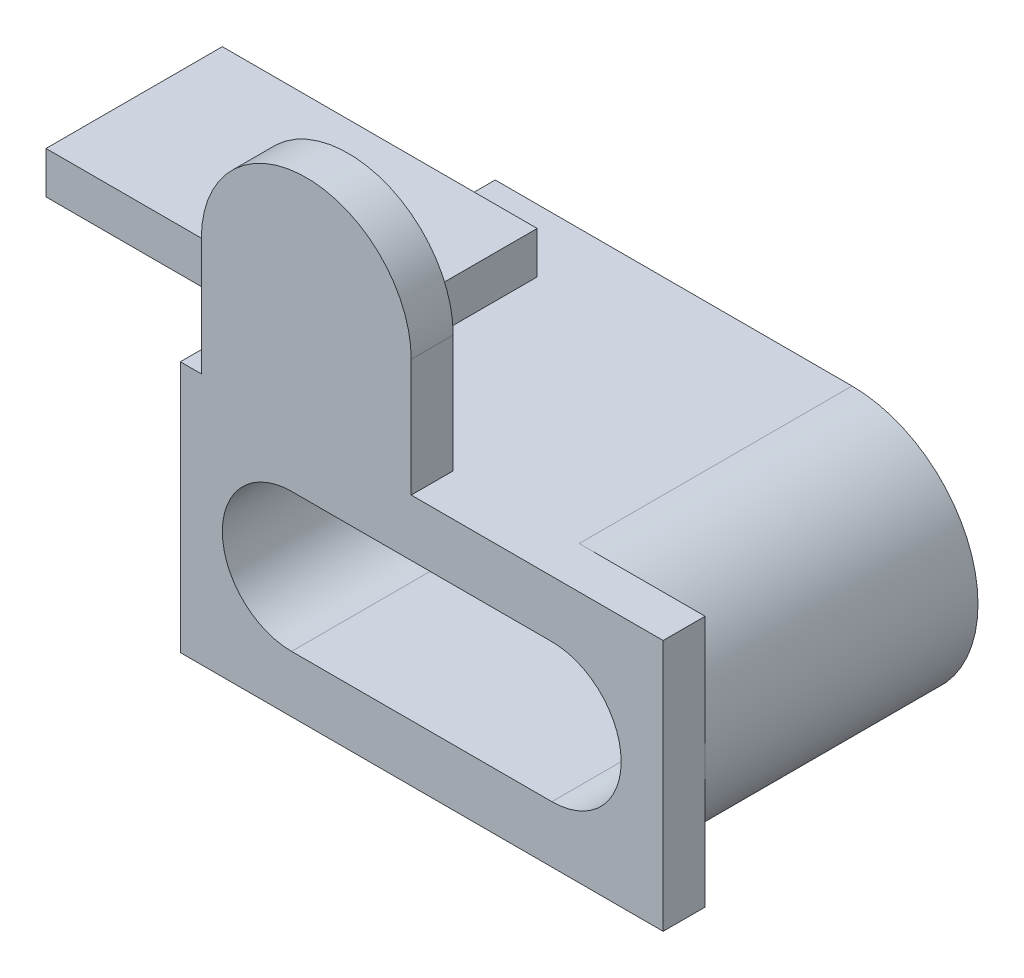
SolidWorks part; units mm, degrees
ref_plane "Ebene vorne" through (0, 0, 0) normal (0, 0, 1) x (1, 0, 0)
ref_plane "Ebene oben" through (0, 0, 0) normal (0, 1, 0) x (1, 0, 0)
ref_plane "Ebene rechts" through (0, 0, 0) normal (1, 0, 0) x (0, 0, -1)
sketch "Skizze1" plane through (0, 0, 0) normal (0, 0, 1) x (1, 0, 0)
  line L0 (-1.1047, -0.1552) -> (5.0953, -0.1552) construction
  line L1 (1.7453, 2.8448) -> (7.7453, 2.8448)
  line L2 (-3.7547, 2.8448) -> (-3.7547, -3.1552)
  line L3 (-3.7547, -3.1552) -> (7.7453, -3.1552)
  line L4 (7.7453, 2.8448) -> (7.7453, -3.1552)
  line L5 (-1.1047, 1.4948) -> (5.0953, 1.4948)
  line L6 (-1.1047, -1.8052) -> (5.0953, -1.8052)
  line L7 (-3.7547, 2.8448) -> (-3.2547, 2.8448)
  line L14 (-3.2547, 2.8448) -> (-3.2547, 5.6448)
  line L16 (1.7453, 2.8448) -> (1.7453, 5.6448)
  arc A0 (-1.1047, 1.4948) -> (-1.1047, -1.8052) centre (-1.1047, -0.1552) ccw
  arc A1 (5.0953, -1.8052) -> (5.0953, 1.4948) centre (5.0953, -0.1552) ccw
  arc A3 (1.7453, 5.6448) -> (-3.2547, 5.6448) centre (-0.7547, 5.6448) ccw
  point P6 (1.9953, -0.1552)
  point P11 (-2.7547, -0.1552)
  point P12 (6.7453, -0.1552)
  point P13 (-1.0047, 8.1448)
  dimension "D1" = 6
  dimension "D2" = 9.5
  dimension "D3" = 3.3
  dimension "D4" = 11.5
  dimension "D5" = 1
  dimension "D6" = 1.35
  dimension "D7" = 0.5
  dimension "D8" = 5.3
extrude "Aufsatz-Linear austragen1" add sketch "Skizze1" along normal blind 7.5
sketch "Skizze2" plane through (0, 0, 7.5) normal (0, 0, 1) x (1, 0, 0)
sketch "Skizze3" plane through (1.7453, 0, 0) normal (1, 0, 0) x (0, 0, -1)
  line L0 (0, 8.1448) -> (-7.5, 8.1448) construction
  line L1 (0, 2.8448) -> (-6.5, 2.8448)
  line L2 (0, 2.8448) -> (0, 8.1448)
  line L3 (0, 8.1448) -> (-6.5, 8.1448)
  line L4 (-6.5, 2.8448) -> (-6.5, 8.1448)
  line L5 (-7.5, 2.8448) -> (-7.5, 5.6448) construction
  dimension "D1" = 1
extrude "Schnitt-Linear austragen1" cut sketch "Skizze3" against normal through all
sketch "Skizze4" plane through (0, 2.8448, 0) normal (0, 1, 0) x (1, 0, 0)
  line L0 (7.7453, 0) -> (-3.7547, 0) construction
  line L1 (1.7453, 0) -> (2.7453, 0)
  line L2 (1.7453, 0) -> (1.7453, -5)
  line L3 (1.7453, -5) -> (2.7453, -5)
  line L4 (2.7453, 0) -> (2.7453, -5)
  line L5 (7.7453, -7.5) -> (1.7453, -7.5) construction
  line L6 (-3.7547, -7.5) -> (-3.7547, 0) construction
  dimension "D1" = 2.5
  dimension "D2" = 1
  dimension "D3" = 6.5
sketch "Skizze8" plane through (0, 0, 0) normal (0, 0, -1) x (-1, 0, 0)
  line L0 (-4.7453, 2.8448) -> (-7.7453, 2.8448)
  line L1 (-7.7453, 2.8448) -> (-7.7453, -0.1552)
  line L2 (-7.7453, -0.1552) -> (-7.7453, 2.8448)
  line L3 (-7.7453, -0.1552) -> (-7.7453, -3.1552)
  line L4 (-7.7453, -3.1552) -> (-4.7453, -3.1552)
  line L5 (-4.7453, -3.1552) -> (0.7547, -3.1552)
  line L6 (0.7547, -3.1552) -> (3.7547, -3.1552)
  line L7 (3.7547, -3.1552) -> (3.7547, 2.8448)
  line L8 (3.7547, 2.8448) -> (0.7547, 2.8448)
  arc A0 (-4.7453, 2.8448) -> (-4.7453, -3.1552) centre (-4.7453, -0.1552) ccw
  arc A1 (0.7547, -3.1552) -> (0.7547, 2.8448) centre (0.7547, -0.1552) ccw
extrude "Schnitt-Linear austragen5" cut sketch "Skizze8" against normal blind 6.5 contours A0 M8 M9 | A0 M9 M10 | A1 L7 M12 | A1 M10 M11
sketch "Skizze9" plane through (0, 0, 0) normal (0, 0, -1) x (-1, 0, 0)
  line L0 (3.7547, 2.8448) -> (3.7547, -3.1552)
  line L1 (3.7547, -3.1552) -> (0.7547, -3.1552)
  line L3 (0.7547, 2.8448) -> (3.7547, 2.8448)
  arc A0 (0.7547, -3.1552) -> (0.7547, 2.8448) centre (0.7547, -0.1552) ccw
extrude "Aufsatz-Linear austragen4" add sketch "Skizze9" against normal blind 6.5 contours L3 L0 M7 | L1 L0 M7
sketch "Skizze10" plane through (0, 2.8448, 0) normal (0, 1, 0) x (1, 0, 0)
  line L0 (1.7453, -6.5) -> (-3.2547, -6.5) construction
  line L1 (-1.2547, -6.5) -> (-3.7547, -6.5)
  line L2 (-1.2547, -6.5) -> (-1.2547, -1.5)
  line L3 (-1.2547, -1.5) -> (-8.7547, -1.5)
  line L4 (-8.7547, -5.7) -> (-8.7547, -1.5)
  line L5 (-3.7547, -7.5) -> (-3.7547, 0) construction
  line L9 (-8.7547, -5.7) -> (-3.7547, -5.7)
  line L10 (-3.7547, -5.7) -> (-3.7547, -6.5)
  dimension "D1" = 5
  dimension "D2" = 5
  dimension "D3" = 2.5
  dimension "D4" = 4.2
extrude "Aufsatz-Linear austragen5" add sketch "Skizze10" along normal blind 1
